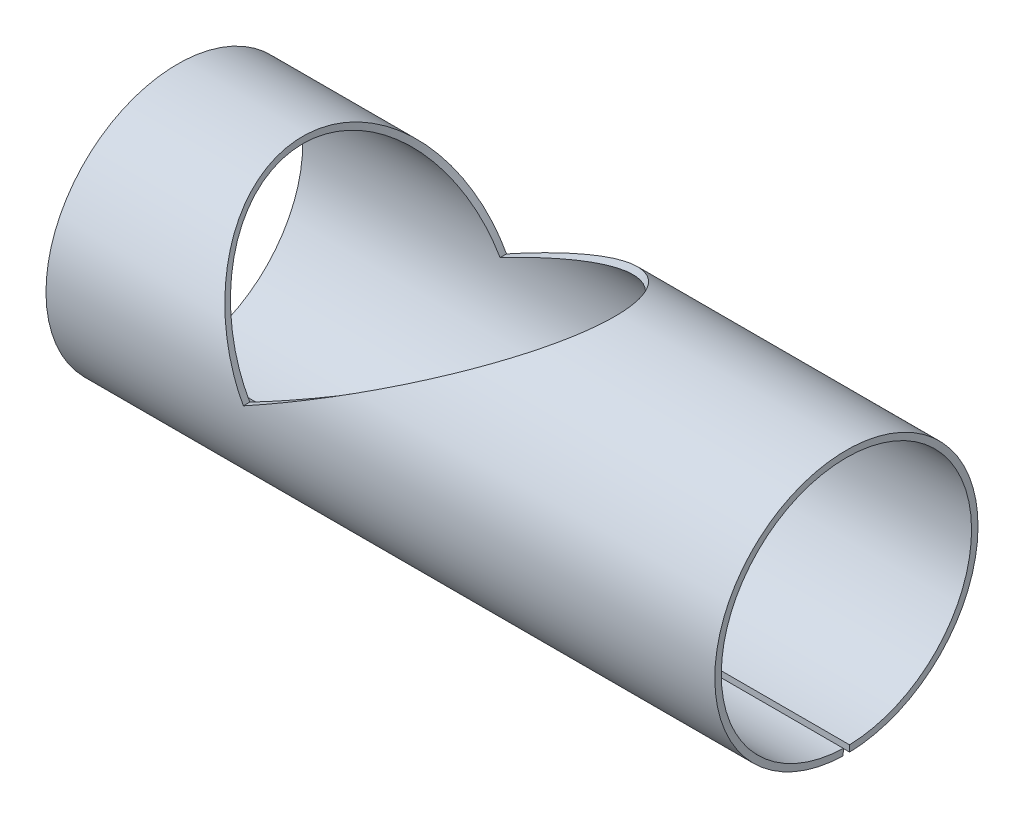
SolidWorks part; units mm, degrees
ref_plane "前视基准面" through (0, 0, 0) normal (0, 0, 1) x (1, 0, 0)
ref_plane "上视基准面" through (0, 0, 0) normal (0, 1, 0) x (1, 0, 0)
ref_plane "右视基准面" through (0, 0, 0) normal (1, 0, 0) x (0, 0, -1)
imported_body "基体零件-斜交三通管（包括垂直正交三通管）-1"
sheet metal parameters "钣金1" parameters "D1"=0.7366, "厚度"=1
bend "圆角折弯1" bend radius 19.3684 bend angle 357.187 parameters "D5"=1
flatten bends "展开-折弯1"
sketch "尖角-草图1" plane through (21.2152, -20.3622, -0.5) normal (0, -0.9997, -0.0245) x (1, 0, 0)
  line L0 (51.7568, -60.372) -> (-51.7568, -60.372) construction
  dimension "D1" = 0
process bends "加工-折弯1" parameters "D1"=0
sketch "平面-草图1" plane through (21.2152, -20.3622, -0.5) normal (0, -0.9997, -0.0245) x (1, 0, 0)
